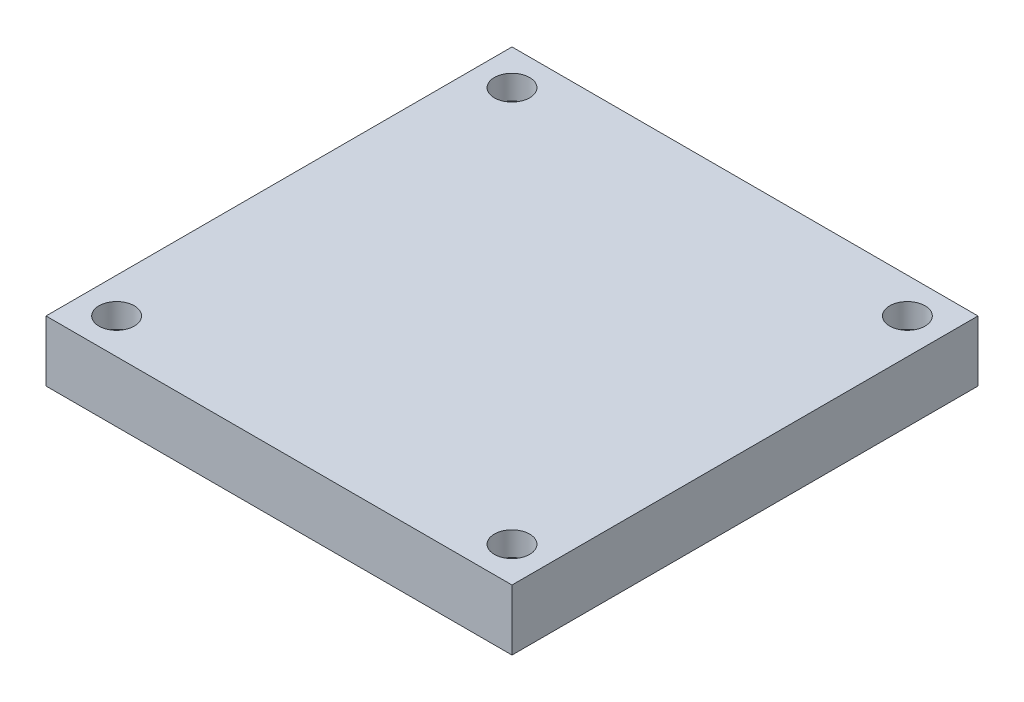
SolidWorks part; units mm, degrees
ref_plane "Спереди" through (0, 0, 0) normal (0, 0, 1) x (1, 0, 0)
ref_plane "Сверху" through (0, 0, 0) normal (0, 1, 0) x (1, 0, 0)
ref_plane "Справа" through (0, 0, 0) normal (1, 0, 0) x (0, 0, -1)
sketch "Эскиз1" plane through (0, 0, 0) normal (0, 1, 0) x (1, 0, 0)
  line L1 (0, 0) -> (33, 0)
  line L2 (0, 0) -> (0, -33)
  line L3 (0, -33) -> (33, -33)
  line L4 (33, 0) -> (33, -33)
  dimension "D1" = 33
  dimension "D2" = 33
extrude "Бобышка-Вытянуть1" add sketch "Эскиз1" along normal blind 4.3
hole_wizard "Цековка для винта с внутренним шестигранником M21" positions "Эскиз3" profile "Эскиз2" counterbore size "M2" standard "ISO"
sketch "Эскиз3" plane through (-0.1114, 0, -4.8818) normal (0, 1, 0) x (-1, 0, 0)
  line L0 (-33.1114, 37.8818) -> (-33.1114, 4.8818) construction
  line L1 (-0.1114, 37.8818) -> (-33.1114, 37.8818) construction
  line L2 (-16.6114, 37.8818) -> (-16.6114, 4.8818) construction
  line L3 (-33.1114, 4.8818) -> (-0.1114, 4.8818) construction
  line L5 (-0.1114, 21.3818) -> (-33.1114, 21.3818) construction
  line L6 (-0.1114, 4.8818) -> (-0.1114, 37.8818) construction
  point P0 (-30.6114, 35.3818)
  point P13 (-2.6114, 35.3818)
  point P15 (-2.6114, 7.3818)
  point P17 (-30.6114, 7.3818)
  dimension "D1" = 28
  dimension "D2" = 28
sketch "Эскиз2" plane through (30.5, 0, 30.5) normal (1, 0, 0) x (0, 0, -1)
  line L0 (0, 0) -> (0, 4.3)
  line L1 (0, 4.3) -> (1.25, 4.3)
  line L3 (1.25, 4.3) -> (1.25, 2.6)
  line L4 (1.25, 2.6) -> (2.1, 2.6)
  line L5 (2.1, 2.6) -> (2.1, 0)
  line L7 (2.1, 0) -> (0, 0)
  line L11 (0, -6.35) -> (0, 107.95) construction
  dimension "Диаметр сквозного отверстия" = 2.5
  dimension "Глубина сквозного отверстия" = 4.3
  dimension "Диаметр цековки" = 4.2
  dimension "Глубина цековки" = 2.6
